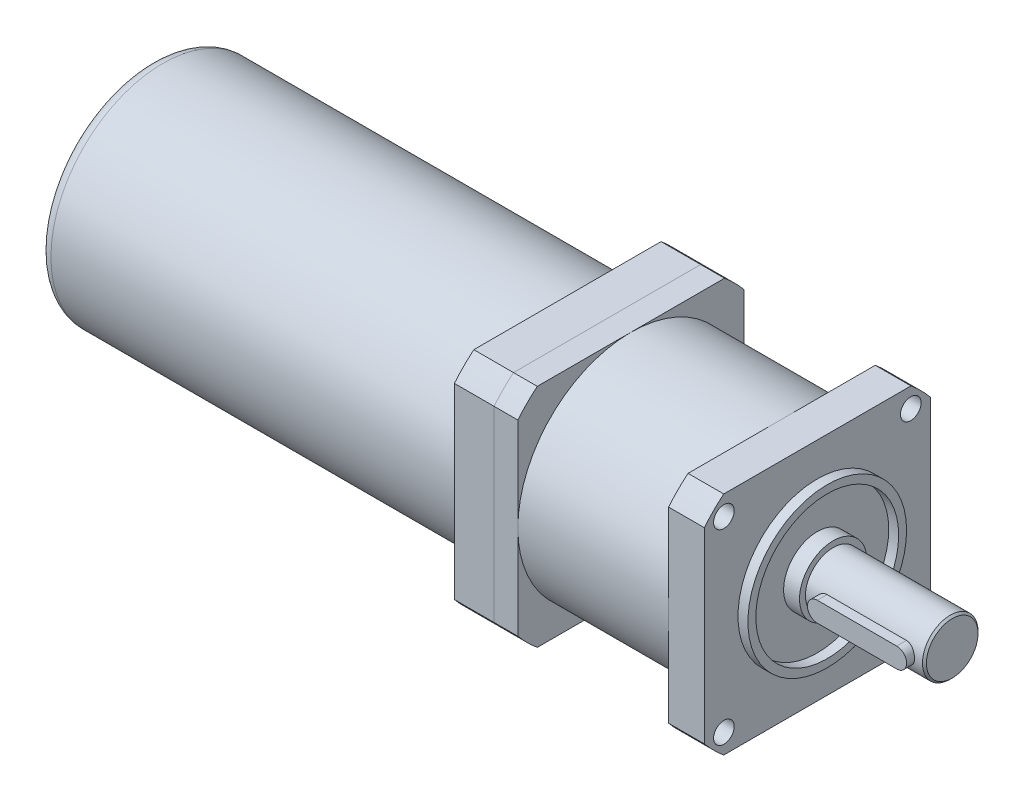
SolidWorks part; units mm, degrees
ref_plane "前视基准面" through (0, 0, 0) normal (0, 0, 1) x (1, 0, 0)
ref_plane "上视基准面" through (0, 0, 0) normal (0, 1, 0) x (1, 0, 0)
ref_plane "右视基准面" through (0, 0, 0) normal (1, 0, 0) x (0, 0, -1)
sketch "草图1" plane through (0, 0, 0) normal (1, 0, 0) x (0, 0, -1)
  line L1 (-23.5956, -28.5) -> (23.5956, -28.5)
  line L2 (-28.5, -23.5956) -> (-28.5, 23.5956)
  line L3 (-23.5956, 28.5) -> (23.5956, 28.5)
  line L4 (28.5, -23.5956) -> (28.5, 23.5956)
  line L5 (-26.163, -26.163) -> (26.163, 26.163) construction
  line L6 (-26.163, 26.163) -> (26.163, -26.163) construction
  arc A0 (-28.5, -23.5956) -> (-23.5956, -28.5) centre (0, 0) ccw
  arc A1 (-23.5956, 28.5) -> (-28.5, 23.5956) centre (0, 0) ccw
  arc A2 (28.5, 23.5956) -> (23.5956, 28.5) centre (0, 0) ccw
  arc A3 (23.5956, -28.5) -> (28.5, -23.5956) centre (0, 0) ccw
  point P0 (0, 0)
extrude "凸台-拉伸1" add sketch "草图1" against normal blind 9
sketch "草图2" plane through (-9, 0, 0) normal (-1, 0, 0) x (0, 0, 1)
  circle A0 centre (0, 0) radius 28.5
extrude "凸台-拉伸2" add sketch "草图2" along normal blind 38
sketch "草图3" plane through (-47, 0, 0) normal (-1, 0, 0) x (0, 0, 1)
  line L1 (-23.5956, -28.5) -> (23.5956, -28.5)
  line L2 (-28.5, -23.5956) -> (-28.5, 23.5956)
  line L3 (-23.5956, 28.5) -> (23.5956, 28.5)
  line L4 (28.5, -23.5956) -> (28.5, 23.5956)
  line L5 (-26.163, -26.163) -> (26.163, 26.163) construction
  line L6 (-26.163, 26.163) -> (26.163, -26.163) construction
  arc A0 (-28.5, -23.5956) -> (-23.5956, -28.5) centre (0, 0) ccw
  arc A1 (23.5956, -28.5) -> (28.5, -23.5956) centre (0, 0) ccw
  arc A2 (28.5, 23.5956) -> (23.5956, 28.5) centre (0, 0) ccw
  arc A3 (-23.5956, 28.5) -> (-28.5, 23.5956) centre (0, 0) ccw
  point P0 (0, 0)
extrude "凸台-拉伸3" add sketch "草图3" along normal blind 6
sketch "草图6" plane through (0, 0, 0) normal (1, 0, 0) x (0, 0, -1)
  circle A0 centre (-23.55, 23.55) radius 2.6
  circle A1 centre (23.55, 23.55) radius 2.6
  circle A2 centre (23.55, -23.55) radius 2.6
  circle A3 centre (-23.55, -23.55) radius 2.6
  point P0 (0, 0)
extrude "切除-拉伸2" cut sketch "草图6" against normal blind 9
sketch "草图7" plane through (0, 0, 0) normal (1, 0, 0) x (0, 0, -1)
  circle A0 centre (0, 0) radius 20
  circle A1 centre (0, 0) radius 18
extrude "凸台-拉伸5" add sketch "草图7" along normal blind 2.5
sketch "草图8" plane through (0, 0, 0) normal (1, 0, 0) x (0, 0, -1)
  circle A0 centre (0, 0) radius 8.5
extrude "凸台-拉伸6" add sketch "草图8" along normal blind 4
sketch "草图9" plane through (4, 0, 0) normal (1, 0, 0) x (0, 0, -1)
  circle A0 centre (0, 0) radius 7
extrude "凸台-拉伸7" add sketch "草图9" along normal blind 30
ref_plane "基准面1" through (0, 0, 7) normal (0, 0, 1) x (1, 0, 0)
sketch "草图10" plane through (0, 0, 7) normal (0, 0, 1) x (1, 0, 0)
  line L3 (9, 2.5) -> (29, 2.5)
  line L5 (29, -2.5) -> (9, -2.5)
  arc A0 (29, -2.5) -> (29, 2.5) centre (29, 0) ccw
  arc A1 (9, 2.5) -> (9, -2.5) centre (9, 0) ccw
extrude "切除-拉伸3" cut sketch "草图10" against normal blind 3
sketch "草图11" plane through (0, 0, 4) normal (0, 0, 1) x (1, 0, 0)
  line L0 (9, 2.5) -> (29, 2.5)
  line L2 (29, -2.5) -> (9, -2.5)
  arc A0 (9, 2.5) -> (9, -2.5) centre (9, 0) ccw
  arc A1 (29, -2.5) -> (29, 2.5) centre (29, 0) ccw
extrude "凸台-拉伸8" add sketch "草图11" along normal blind 5
chamfer "倒角1" distance 0.5 angle 45 1 edges at (34, 0, -7)
sketch "草图14" plane through (-53, 0, 0) normal (-1, 0, 0) x (0, 0, 1)
  line L1 (-23.5956, -28.5) -> (23.5956, -28.5)
  line L2 (-28.5, -23.5956) -> (-28.5, 23.5956)
  line L3 (-23.5956, 28.5) -> (23.5956, 28.5)
  line L4 (28.5, -23.5956) -> (28.5, 23.5956)
  line L5 (-26.163, -26.163) -> (26.163, 26.163) construction
  line L6 (-26.163, 26.163) -> (26.163, -26.163) construction
  arc A0 (-23.5956, 28.5) -> (-28.5, 23.5956) centre (0, 0) ccw
  arc A1 (-28.5, -23.5956) -> (-23.5956, -28.5) centre (0, 0) ccw
  arc A2 (23.5956, -28.5) -> (28.5, -23.5956) centre (0, 0) ccw
  arc A3 (28.5, 23.5956) -> (23.5956, 28.5) centre (0, 0) ccw
  point P0 (0, 0)
extrude "凸台-拉伸9" add sketch "草图14" along normal blind 10 separate body
sketch "草图15" plane through (-63, 0, 0) normal (-1, 0, 0) x (0, 0, 1)
  circle A0 centre (0, 0) radius 28.2
extrude "凸台-拉伸10" add sketch "草图15" along normal blind 105
fillet "圆角1" radius 3 1 edges at (-168, 0, 28.2)
